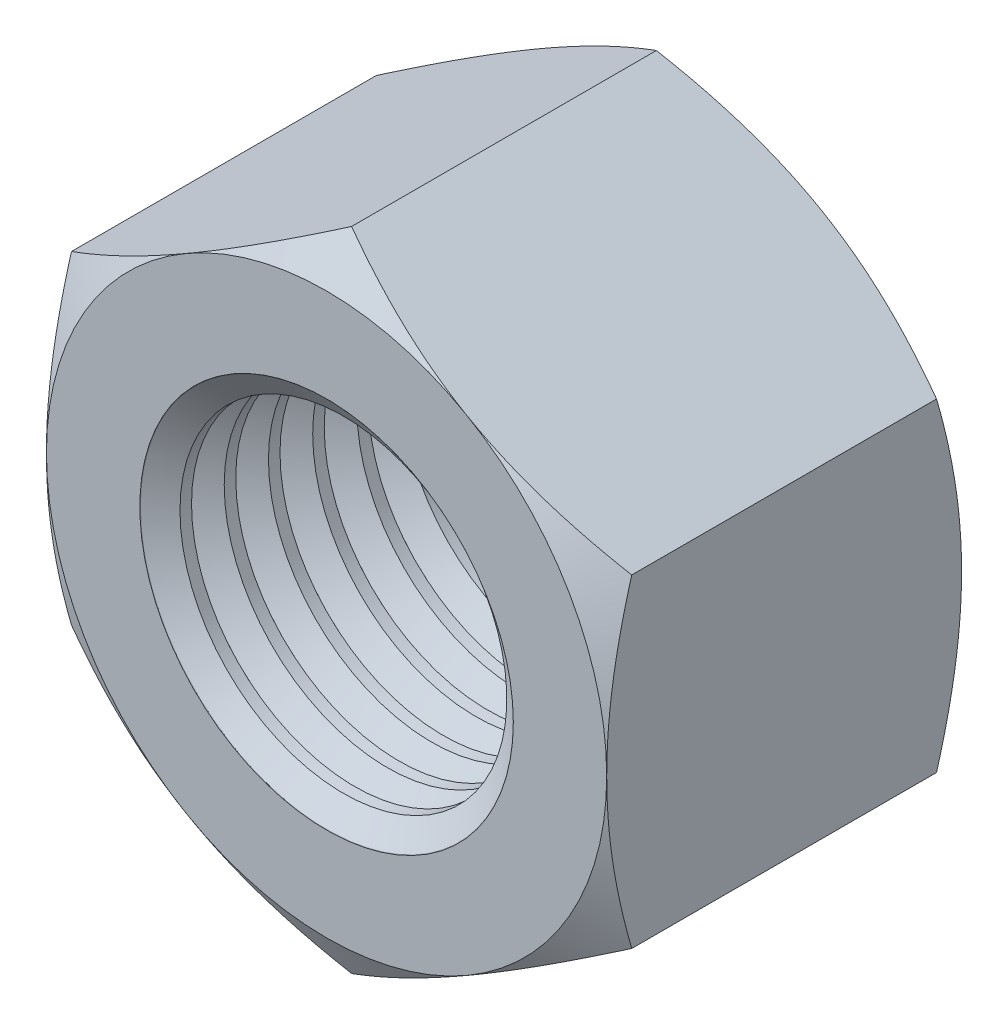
SolidWorks part; units mm, degrees
ref_plane "Plane1" through (0, 0, 0) normal (0, 0, 1) x (1, 0, 0)
ref_plane "Plane2" through (0, 0, 0) normal (0, 1, 0) x (1, 0, 0)
ref_plane "Plane3" through (0, 0, 0) normal (1, 0, 0) x (0, 0, -1)
revolve "EndChamfer" cut sketch "Sketch5"
sketch "Sketch5"
  line L0 (18.9746, 10) -> (18.0118, 8.625)
  line L1 (19.0254, 10) -> (18.9746, 10)
  line L2 (19.0254, 10) -> (19.0254, 8.625)
  line L3 (19.0254, 8.625) -> (18.0118, 8.625)
  line L6 (-0.0508, 10) -> (0, 10)
  line L7 (0, 10) -> (0.9628, 8.625)
  line L9 (0.9628, 8.625) -> (-0.0508, 8.625)
  line L10 (-0.0508, 8.625) -> (-0.0508, 10)
  line L11 (25.0375, 0) -> (38.388, 0) construction
  line L12 (19, 0) -> (0, 0) construction
extrude "BaseNut" add sketch "BaseNutSke" against normal blind 19
sketch "BaseNutSke" plane through (0, 0, 0) normal (0, 0, 1) x (1, 0, 0)
  line L6 (15, 8.6603) -> (15, -8.6603)
  line L7 (-15, 8.6603) -> (-15, -8.6603)
  line L8 (15, 8.6603) -> (0, 17.3205)
  line L9 (0, 17.3205) -> (-15, 8.6603)
  line L10 (-15, -8.6603) -> (0, -17.3205)
  line L11 (0, -17.3205) -> (15, -8.6603)
  circle A0 centre (0, 0) radius 8.75
  dimension "D4" = 15
  dimension "Tap_drill" = 17.5
  dimension "D1" = 120
  dimension "D2" = 15
  dimension "D3" = 15
  dimension "Width_flats" = 30
pattern_linear "ThdSchPat" count 8 spacing 2.3687 along (0, 0, -1)
revolve "ThreadSchematic" cut sketch "ThdSchSke" angle 360 about L6
sketch "ThdSchSke" plane through (0, 0, 0) normal (0, 1, 0) x (1, 0, 0)
  line L0 (-10, 0.0254) -> (-8.75, 0.9007)
  line L1 (-8.75, 0.9007) -> (-4.375, 0.9007)
  line L2 (-4.375, 0.9007) -> (-4.375, -0.8499)
  line L3 (-4.375, -0.8499) -> (-8.75, -0.8499)
  line L4 (-8.75, -0.8499) -> (-10, 0.0254)
  line L5 (-3.175, 2.5) -> (3.175, 2.5) construction
  line L6 (0, 2.5) -> (0, -2.9874) construction
  line L7 (0, 18.0993) -> (0, 0.8753) construction
  dimension "D1" = 0.0254
  dimension "VeeAngle" = 70
  dimension "SideAngle" = 55
  dimension "OverCut" = 8.75
  dimension "Tap_Drill" = 17.5
  dimension "Advance" = 2.5
  dimension "Thread_major" = 20
sketch "Sketch3" plane through (0, 0, 0) normal (1, 0, 0) x (0, 0, -1)
  line L0 (19, 15) -> (17.6603, 17.3205)
  line L1 (17.6603, 17.3205) -> (17.6603, 27.3205)
  line L2 (17.6603, 27.3205) -> (29, 27.3205)
  line L3 (29, 27.3205) -> (29, 15)
  line L4 (29, 15) -> (19, 15)
  line L5 (19, 8.6603) -> (19, 17.3205) construction
  line L6 (19, 17.3205) -> (0, 17.3205) construction
  line L7 (0, 0) -> (38.6776, 0) construction
  line L8 (19, 0) -> (0, 0) construction
  line L9 (9.5, 17.3205) -> (9.5, 44.222) construction
  line L10 (1.3397, 27.3205) -> (-10, 27.3205)
  line L11 (-10, 27.3205) -> (-10, 15)
  line L12 (-10, 15) -> (0, 15)
  line L13 (0, 15) -> (1.3397, 17.3205)
  line L14 (1.3397, 17.3205) -> (1.3397, 27.3205)
  line L16 (19, 17.3205) -> (0, 17.3205) construction
  dimension "D1" = 15
  dimension "D2" = 30
  dimension "D3" = 10
  dimension "D4" = 10
revolve "Double-Chamfer" cut sketch "Sketch3" angle 360 about L7
equation "\"D2@BaseNutSke\" = \"Width_flats@BaseNutSke\" / 2"
equation "\"D3@BaseNutSke\" = \"Width_flats@BaseNutSke\" / 2"
equation "\"D1@Sketch3\" = \"Width_flats@BaseNutSke\" /2"
equation "\"D4@BaseNutSke\" = \"D3@BaseNutSke\""
equation "\"Thread_major@ThdSchSke\" = \"Thread_major@ThreadCosmetic\""
equation "\"Tap_drill@ThdSchSke\" = \"Tap_drill@BaseNutSke\""
equation "\"Overcut@ThdSchSke\" = \"Tap_drill@ThdSchSke\" * 0.5"
equation "\"Num_threads@ThdSchPat\" = int(  ( \"Thickness@BaseNut\" - 0.0508 ) / \"Advance@ThdSchSke\" + 0.999 )  + 1"
equation "\"Advance@ThdSchPat\" = ( \"Thickness@BaseNut\" - 0.0508 ) /  (\"Num_threads@ThdSchPat\" - 1) 'relax it"
equation "' \"Num_threads@ThdSchPat\" = \"Num_threads@ThdSchPat\" - sgn( \"Num_threads@ThdSchPat\" - 1) '---chamfered tips only---"
equation "\"ThreadMajor@Sketch5\" = \"Thread_major@ThreadCosmetic\" * 0.5"
equation "\"ChamferDepth@Sketch5\" = (\"Thread_major@ThreadCosmetic\" - \"Tap_drill@BaseNutSke\") * 0.55"
equation "\"Offset1@Sketch5\" = \"Thickness@BaseNut\" + 0.0254"
equation "\"Offset2@Sketch5\" = \"Offset1@Sketch5\" + 0.0508"
